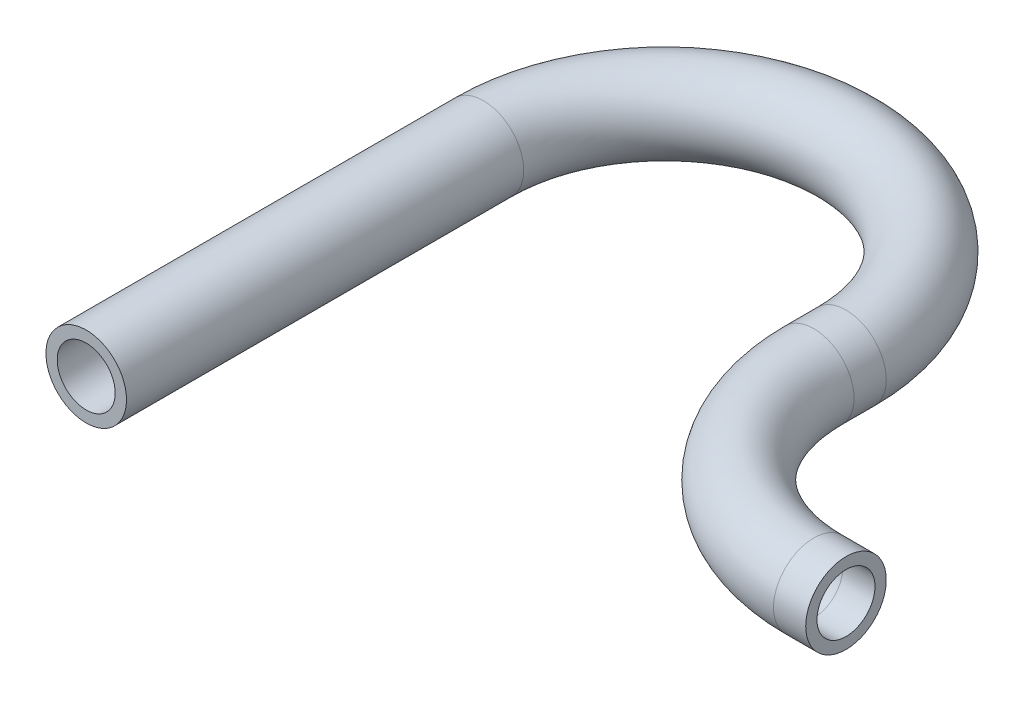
SolidWorks part; units mm, degrees
ref_plane "Front Plane" through (0, 0, 0) normal (0, 0, 1) x (1, 0, 0)
ref_plane "Top Plane" through (0, 0, 0) normal (0, 1, 0) x (1, 0, 0)
ref_plane "Right Plane" through (0, 0, 0) normal (1, 0, 0) x (0, 0, -1)
sketch "Sketch1" plane through (0, 0, 0) normal (0, 1, 0) x (1, 0, 0)
  line L0 (0, 0) -> (0, 31.3055)
  line L1 (0, 31.3055) -> (14.2875, 31.3055) construction
  line L2 (28.575, 31.3055) -> (28.575, 28.7655)
  line L3 (28.575, 28.7655) -> (42.8625, 28.7655) construction
  line L4 (42.8625, 14.478) -> (45.4025, 14.478)
  arc A0 (0, 31.3055) -> (28.575, 31.3055) centre (14.2875, 31.3055) cw
  arc A1 (28.575, 28.7655) -> (42.8625, 14.478) centre (42.8625, 28.7655) ccw
  dimension "D2" = 14.2875
  dimension "D4" = 2.54
  dimension "D1" = 45.4025
  dimension "D3" = 14.2875
  dimension "D6" = 14.478
sketch "Sketch2" plane through (0, 0, 0) normal (0, 0, 1) x (1, 0, 0)
  circle A0 centre (0, 0) radius 3.175
  circle A1 centre (0, 0) radius 2.286
sweep "Sweep1" add profiles "Sketch2" path "Sketch1"
sketch "Sketch3" plane through (0, 0, 0) normal (0, 1, 0) x (1, 0, 0)
  line L0 (0, 0) -> (0, -5.08)
